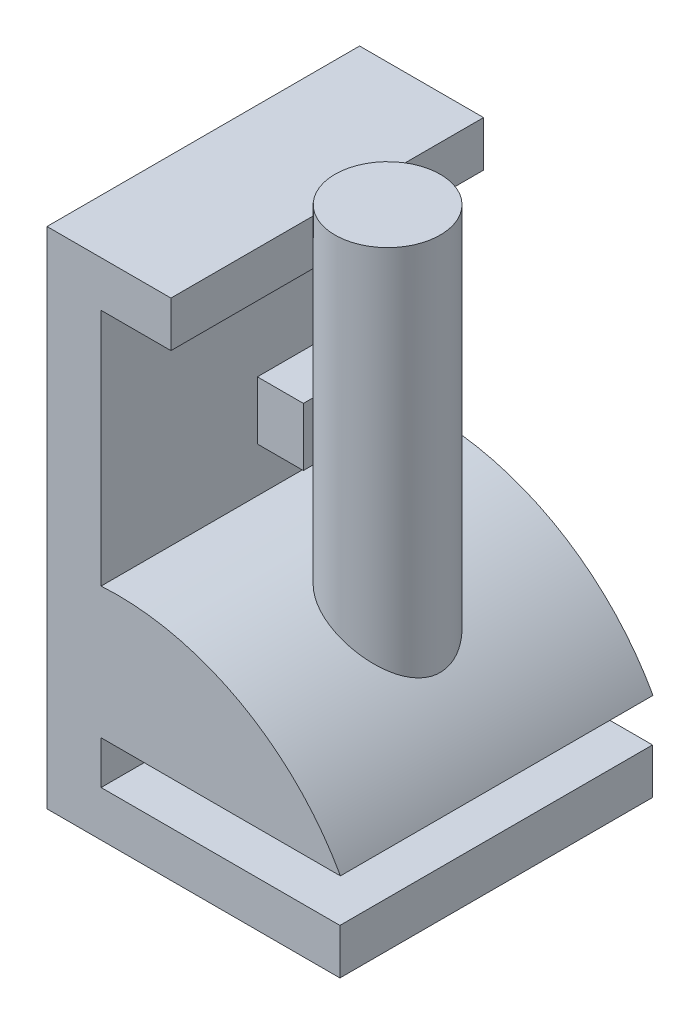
SolidWorks part; units mm, degrees
ref_plane "Front" through (0, 0, 0) normal (0, 0, 1) x (1, 0, 0)
ref_plane "Top" through (0, 0, 0) normal (0, 1, 0) x (1, 0, 0)
ref_plane "Right" through (0, 0, 0) normal (1, 0, 0) x (0, 0, -1)
sketch "Sketch1" plane through (8.5643, -28.3878, 0) normal (0, 0, 1) x (0, 1, 0)
  line L0 (-58.1634, -54.4213) -> (95.1155, -54.4213)
  line L4 (95.1155, -54.4213) -> (95.1155, -92.0903)
  line L6 (-58.1634, -143.4403) -> (-58.1634, -54.4213)
  line L16 (-131.7247, -54.4213) -> (174.6253, -54.4213) construction
  line L17 (8.6933, -70.8632) -> (22.3345, -70.8632)
  line L18 (40.0175, -70.8632) -> (81.2746, -70.8632)
  line L19 (40.0175, -84.8357) -> (40.0175, -70.8632)
  line L20 (22.3345, -84.8357) -> (40.0175, -84.8357)
  line L21 (22.3345, -70.8632) -> (22.3345, -84.8357)
  line L24 (-31.2198, -70.8632) -> (-31.2198, -143.5861)
  line L25 (-58.1634, -143.4403) -> (-44.3225, -143.4403)
  line L26 (81.2746, -92.0903) -> (95.1155, -92.0903)
  line L27 (81.2746, -70.8632) -> (81.2746, -92.0903)
  line L28 (-44.3225, -70.8632) -> (-31.2198, -70.8632)
  line L29 (-44.3225, -143.4403) -> (-44.3225, -70.8632)
  arc A0 (8.6933, -70.8632) -> (-31.2198, -143.5861) centre (-68.5772, -75.7686) cw
extrude "Extrude1" add sketch "Sketch1" along normal mid plane 95
ref_plane "Plane1" through (0, 76.7276, 0) normal (0, 1, 0) x (-1, 0, 0)
sketch "Sketch3" plane through (0, 11.6297, 0) normal (0, 1, 0) x (-1, 0, 0)
  line L0 (-79.4274, 0) -> (-93.3999, 0)
  line L4 (-93.3999, -47.5) -> (-79.4274, -47.5)
  line L5 (-79.4274, -47.5) -> (-79.4274, 47.5)
  line L6 (-79.4274, 47.5) -> (-93.3999, 47.5)
  line L7 (-93.3999, 47.5) -> (-93.3999, -47.5)
  line L9 (-79.4274, 0) -> (-79.4274, 47.5)
  line L10 (-79.4274, 47.5) -> (-93.3999, 47.5)
  line L11 (-93.3999, 47.5) -> (-93.3999, 0)
  dimension "D1" = 0
extrude "Cut-Extrude1" cut sketch "Sketch3" against normal up to next
sketch "Sketch2" plane through (0, 76.7276, 0) normal (0, 1, 0) x (-1, 0, 0)
  circle A0 centre (-118.9971, 0) radius 15.9977
extrude "Boss-Extrude1" add sketch "Sketch2" against normal up to surface (98.5505 mm away)
